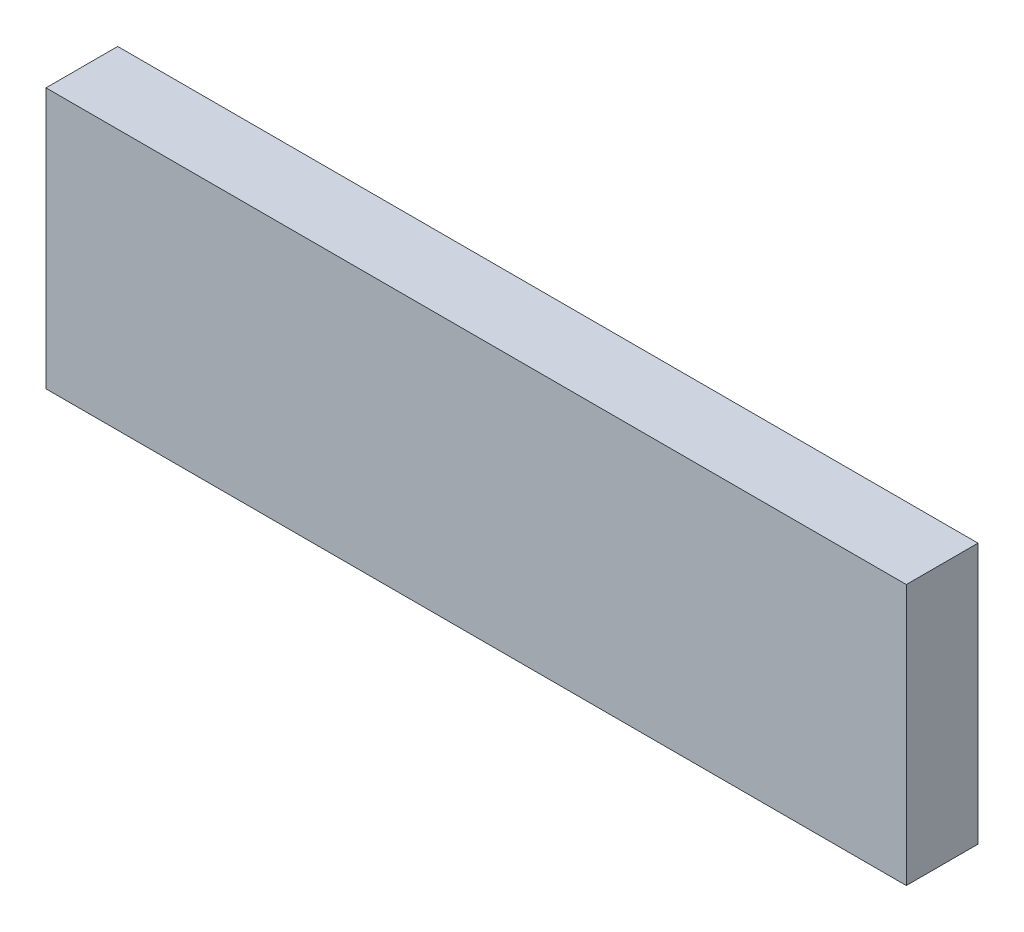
SolidWorks part; units mm, degrees
ref_plane "Front Plane" through (0, 0, 0) normal (0, 0, 1) x (1, 0, 0)
ref_plane "Top Plane" through (0, 0, 0) normal (0, 1, 0) x (1, 0, 0)
ref_plane "Right Plane" through (0, 0, 0) normal (1, 0, 0) x (0, 0, -1)
sketch "Sketch1" plane through (0, 0, 0) normal (0, 0, 1) x (1, 0, 0)
  line L1 (0, 0) -> (66, 0)
  line L2 (0, 0) -> (0, 20)
  line L3 (0, 20) -> (66, 20)
  line L4 (66, 0) -> (66, 20)
  dimension "D1" = 20
  dimension "D2" = 66
extrude "Boss-Extrude1" add sketch "Sketch1" along normal blind 5.5
